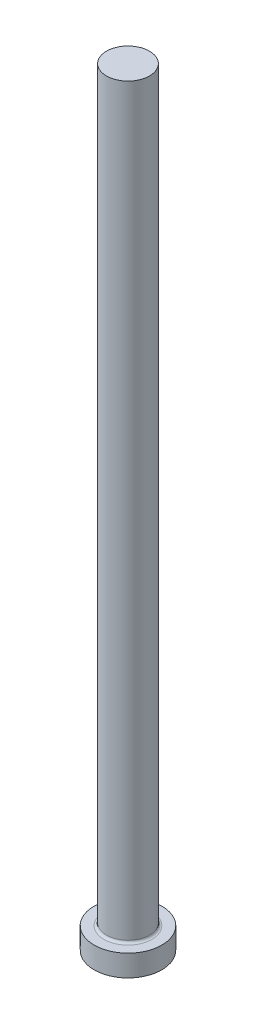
SolidWorks part; units mm, degrees
ref_plane "Plano frontal" through (0, 0, 0) normal (0, 0, 1) x (1, 0, 0)
ref_plane "Plano superior" through (0, 0, 0) normal (0, 1, 0) x (1, 0, 0)
ref_plane "Plano direito" through (0, 0, 0) normal (1, 0, 0) x (0, 0, -1)
sketch "Esboço1" plane through (0, 0, 0) normal (0, 0, 1) x (1, 0, 0)
  line L0 (0, 0) -> (11, 0)
  line L1 (11, 0) -> (11, 7)
  line L2 (11, 7) -> (7.8, 7)
  line L3 (7, 7.8) -> (7, 250)
  line L4 (7, 250) -> (0, 250)
  line L5 (0, 250) -> (0, 0) construction
  line L6 (0, 0) -> (0, 250)
  arc A0 (7.8, 7) -> (7, 7.8) centre (7.8, 7.8) cw
  dimension "D3" = 0.8
  dimension "D1" = 22
  dimension "D2" = 14
  dimension "D4" = 7
  dimension "D5" = 250
revolve "Revolução1" add sketch "Esboço1" angle 360 about L5
sketch "Esboço2"
  dimension "D1" = 0.825
  dimension "D2" = 1.925
  dimension "D3" = 1.2375
  dimension "D4" = 5.9125
wrap "Envolver1" sketch "Esboço2" wrap type deboss source sketch "Esboço2" thickness 0.1 parameters "D1"=0.1
